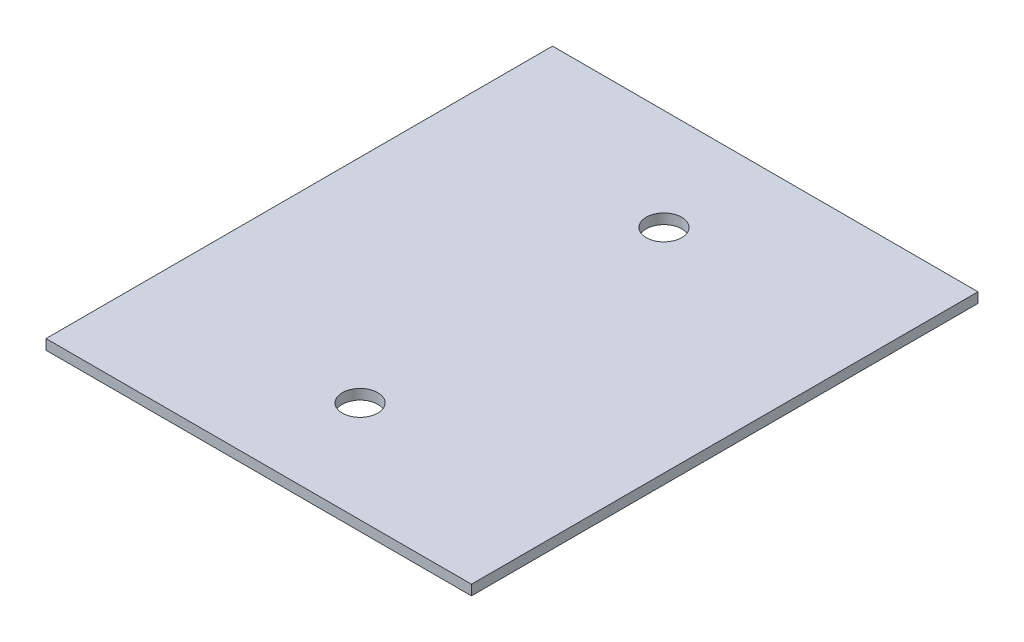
SolidWorks part; units mm, degrees
ref_plane "Front Plane" through (0, 0, 0) normal (0, 0, 1) x (1, 0, 0)
ref_plane "Top Plane" through (0, 0, 0) normal (0, 1, 0) x (1, 0, 0)
ref_plane "Right Plane" through (0, 0, 0) normal (1, 0, 0) x (0, 0, -1)
sketch "Sketch1" plane through (0, 0, 0) normal (0, 1, 0) x (1, 0, 0)
  line L0 (21, 50) -> (21, 0) construction
  line L1 (0, 0) -> (42, 0)
  line L2 (0, 0) -> (0, 50)
  line L3 (0, 50) -> (42, 50)
  line L4 (42, 0) -> (42, 50)
  circle A0 centre (21, 40) radius 1.75
  circle A1 centre (21, 10) radius 1.75
  dimension "D3" = 10
  dimension "D4" = 3.5
  dimension "D5" = 10
  dimension "D6" = 3.5
  dimension "D1" = 42
  dimension "D2" = 50
extrude "Boss-Extrude1" add sketch "Sketch1" along normal blind 1
